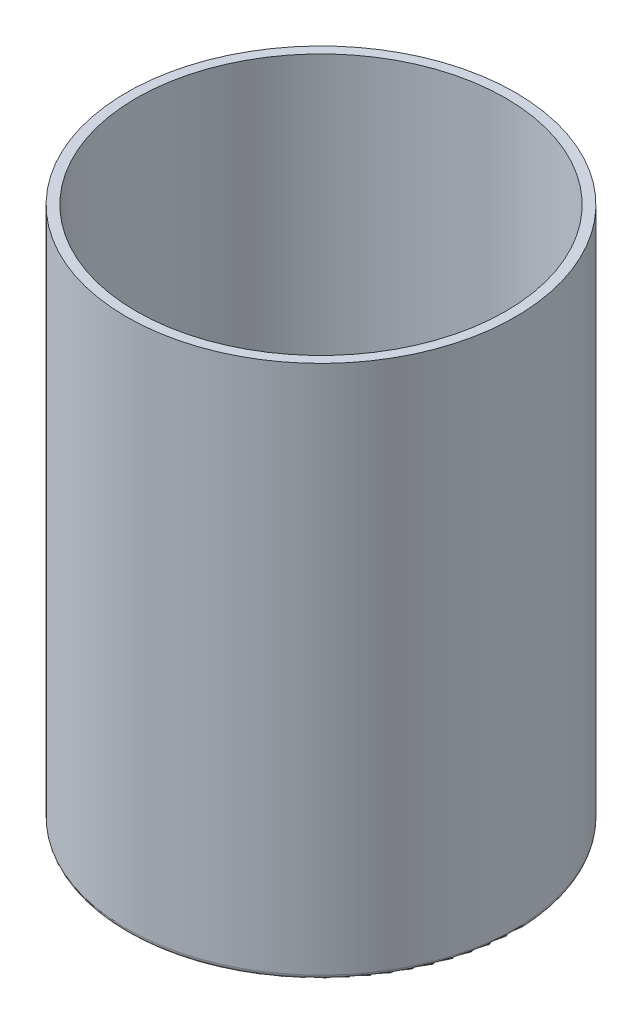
SolidWorks part; units mm, degrees
ref_plane "Alzado" through (0, 0, 0) normal (0, 0, 1) x (1, 0, 0)
ref_plane "Planta" through (0, 0, 0) normal (0, 1, 0) x (1, 0, 0)
ref_plane "Vista lateral" through (0, 0, 0) normal (1, 0, 0) x (0, 0, -1)
sketch "Croquis1" plane through (0, 0, 0) normal (0, 1, 0) x (1, 0, 0)
  circle A0 centre (0, 0) radius 40
  dimension "D1" = 80
extrude "Saliente-Extruir1" add sketch "Croquis1" against normal blind 110
shell "Vaciado1" thickness 2
fillet "Redondeo1" radius 1 1 edges at (0, -110, 40)
